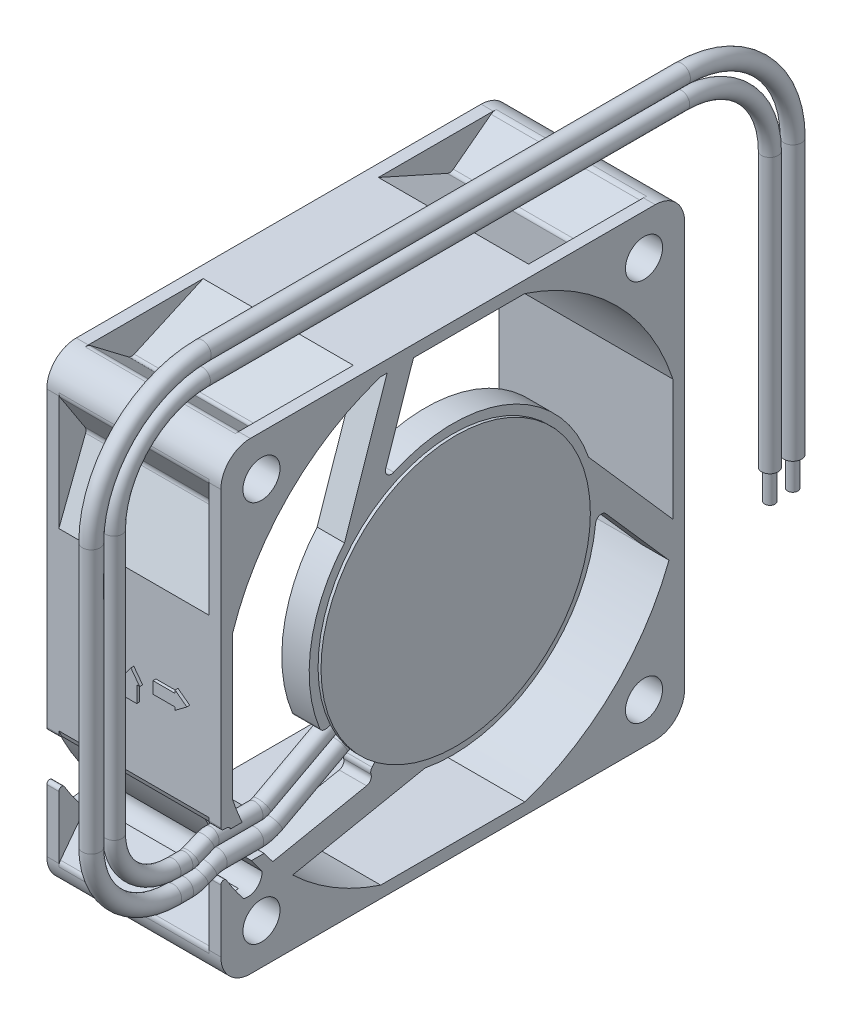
SolidWorks part; units mm, degrees
ref_plane "Front Plane" through (0, 0, 0) normal (0, 0, 1) x (1, 0, 0)
ref_plane "Top Plane" through (0, 0, 0) normal (0, 1, 0) x (1, 0, 0)
ref_plane "Right Plane" through (0, 0, 0) normal (1, 0, 0) x (0, 0, -1)
sketch "Sketch1" plane through (0, 0, 0) normal (1, 0, 0) x (0, 0, -1)
  line L0 (0, 0) -> (0, 40.005) construction
  line L1 (-20.0025, 2.54) -> (-20.0025, 37.465)
  line L2 (20.0025, 2.54) -> (20.0025, 37.465)
  line L3 (-17.4625, 40.005) -> (17.4625, 40.005)
  line L4 (17.4625, 0) -> (-17.4625, 0)
  line L5 (-20.0025, 0) -> (-20.0025, 40.005) construction
  line L6 (20.0025, 0) -> (20.0025, 40.005) construction
  line L7 (-20.0025, 20.0025) -> (20.0025, 20.0025) construction
  arc A0 (-20.0025, 37.465) -> (-17.4625, 40.005) centre (-17.4625, 37.465) cw
  arc A1 (-20.0025, 2.54) -> (-17.4625, 0) centre (-17.4625, 2.54) ccw
  arc A2 (17.4625, 0) -> (20.0025, 2.54) centre (17.4625, 2.54) ccw
  arc A3 (17.4625, 40.005) -> (20.0025, 37.465) centre (17.4625, 37.465) cw
  dimension "D4" = 2.54
  dimension "D1" = 40.005
  dimension "D5" = 20.0025
  dimension "D6" = 17.4625
  dimension "D2" = 20.0025
  dimension "D3" = 20.0025
extrude "Extrude1" add sketch "Sketch1" against normal blind 15.0114
sketch "Sketch2" plane through (0, 0, 0) normal (1, 0, 0) x (0, 0, -1)
  line L0 (0, 40.005) -> (0, 0) construction
  line L1 (17.4625, 40.005) -> (-17.4625, 40.005) construction
  line L2 (-20.0025, 20.0025) -> (20.0025, 20.0025) construction
  line L3 (-20.0025, 37.465) -> (-20.0025, 2.54) construction
  line L4 (20.0025, 2.54) -> (20.0025, 37.465) construction
  line L7 (-17.4625, 0) -> (17.4625, 0) construction
  circle A1 centre (-16.4973, 36.4998) radius 1.6002
  circle A2 centre (16.4973, 36.4998) radius 1.6002
  circle A3 centre (16.4973, 3.5052) radius 1.6002
  circle A4 centre (-16.4973, 3.5052) radius 1.6002
  dimension "D5" = 3.2004
  dimension "D6" = 3.2004
  dimension "D7" = 3.2004
  dimension "D8" = 3.2004
  dimension "D1" = 3.5052
  dimension "D2" = 3.5052
  dimension "D3" = 3.5052
  dimension "D4" = 3.5052
  dimension "D9" = 3.5052
  dimension "D10" = 3.5052
  dimension "D11" = 3.5052
  dimension "D12" = 3.5052
extrude "Extrude2" cut sketch "Sketch2" against normal mid plane 48.0314
sketch "Sketch3" plane through (0, 0, 0) normal (1, 0, 0) x (0, 0, -1)
  line L0 (0, 40.005) -> (0, 0) construction
  line L1 (17.4625, 40.005) -> (-17.4625, 40.005) construction
  line L2 (-20.0025, 20.0025) -> (20.0025, 20.0025) construction
  line L3 (-20.0025, 37.465) -> (-20.0025, 2.54) construction
  line L4 (20.0025, 2.54) -> (20.0025, 37.465) construction
  line L5 (11.7132, 24.0184) -> (18.9865, 15.7426)
  line L6 (13.2074, 19.0478) -> (18.6535, 12.8511)
  line L7 (-17.4625, 0) -> (17.4625, 0) construction
  line L8 (-5.7769, 31.9178) -> (-3.3849, 38.989)
  line L9 (-9.3345, 28.1384) -> (-5.6641, 38.989)
  line L10 (-2.3787, 7.8506) -> (-13.8074, 5.5647)
  line L11 (-3.3849, 38.989) -> (6.2135, 38.989)
  line L12 (-7.4305, 9.0419) -> (-15.52, 7.4238)
  line L17 (-6.2135, 38.989) -> (-5.6641, 38.989)
  line L19 (6.2135, 1.016) -> (-6.2135, 1.016)
  line L20 (18.9865, 26.216) -> (18.9865, 15.7426)
  line L25 (-18.9865, 13.789) -> (-18.9865, 26.216)
  arc A0 (-9.3345, 28.1384) -> (-7.2333, 9.9524) centre (0, 20.0025) ccw
  arc A1 (-18.9865, 13.789) -> (-15.52, 7.4238) centre (0, 20.0025) ccw
  arc A2 (-6.2135, 38.989) -> (-18.9865, 26.216) centre (0, 20.0025) ccw
  arc A3 (18.9865, 26.216) -> (6.2135, 38.989) centre (0, 20.0025) ccw
  arc A4 (6.2135, 1.016) -> (18.6535, 12.8511) centre (0, 20.0025) ccw
  arc A5 (11.7132, 24.0184) -> (-5.087, 31.2918) centre (0, 20.0025) ccw
  arc A6 (-13.8074, 5.5647) -> (-6.2135, 1.016) centre (0, 20.0025) ccw
  arc A7 (-2.3787, 7.8506) -> (12.3203, 18.7633) centre (0, 20.0025) ccw
  arc A8 (-5.7769, 31.9178) -> (-5.087, 31.2918) centre (-5.2957, 31.755) ccw
  arc A9 (12.3203, 18.7633) -> (13.2074, 19.0478) centre (12.8258, 18.7125) cw
  arc A10 (-7.4305, 9.0419) -> (-7.2333, 9.9524) centre (-7.5301, 9.5401) ccw
  dimension "D1" = 0.508
  dimension "D5" = 1.016
  dimension "D9" = 12.3825
  dimension "D10" = 19.9773
  dimension "D3" = 1.016
  dimension "D4" = 1.016
  dimension "D8" = 2.159
  dimension "D6" = 3.3849
  dimension "D7" = 18.689
  dimension "D2" = 1.016
  dimension "D11" = 8.2498
  dimension "D12" = 11.7132
  dimension "D13" = 4.2599
  dimension "D14" = 2.159
  dimension "D15" = 78.689
  dimension "D16" = 1.8592
  dimension "D17" = 2.8915
extrude "Extrude3" cut sketch "Sketch3" against normal mid plane 48.0314
sketch "Sketch4" plane through (-15.0114, 0, 0) normal (-1, 0, 0) x (0, 0, 1)
  line L0 (-20.0025, 2.54) -> (-20.0025, 37.465) construction
  line L1 (3.3849, 38.989) -> (5.7769, 31.9178)
  line L2 (20.0025, 37.465) -> (20.0025, 2.54) construction
  line L3 (5.6641, 38.989) -> (9.3345, 28.1384)
  line L6 (15.52, 7.4238) -> (7.4305, 9.0419)
  line L7 (13.8074, 5.5647) -> (2.3787, 7.8506)
  line L8 (-18.6535, 12.8511) -> (-13.2074, 19.0478)
  line L9 (-18.9865, 15.7426) -> (-11.7132, 24.0184)
  line L12 (5.6641, 38.989) -> (3.3849, 38.989)
  arc A5 (13.8074, 5.5647) -> (15.52, 7.4238) centre (-17.3441, 35.98) ccw
  arc A6 (-18.6535, 12.8511) -> (-18.9865, 15.7426) centre (-6.2674, 15.7426) cw
  arc A7 (-13.2074, 19.0478) -> (-12.3203, 18.7633) centre (-12.8258, 18.7125) cw
  arc A8 (7.4305, 9.0419) -> (7.2333, 9.9524) centre (7.5301, 9.5401) cw
  arc A9 (5.7769, 31.9178) -> (5.087, 31.2918) centre (5.2957, 31.755) cw
  arc A10 (5.087, 31.2918) -> (-11.7132, 24.0184) centre (0, 20.0025) ccw
  arc A11 (-12.3203, 18.7633) -> (2.3787, 7.8506) centre (0, 20.0025) ccw
  arc A12 (7.2333, 9.9524) -> (9.3345, 28.1384) centre (0, 20.0025) ccw
  dimension "D1" = 13.7351
  dimension "D2" = 37.3466
extrude "Extrude4" cut sketch "Sketch4" against normal blind 12.6492
sketch "Sketch5" plane through (-2.3622, 0, 0) normal (-1, 0, 0) x (0, 0, 1)
  line L0 (19.58, 11.938) -> (20.0025, 11.938)
  line L1 (20.0025, 37.465) -> (20.0025, 2.54) construction
  line L2 (20.0025, 11.938) -> (20.0025, 8.8565)
  line L3 (17.4625, 0) -> (-17.4625, 0) construction
  arc A0 (15.7053, 6.264) -> (19.8314, 13.5125) centre (0, 20.0025) ccw construction
  arc A1 (16.4515, 7.1668) -> (18.0535, 5.9169) centre (17.6885, 7.1006) ccw
  arc A2 (16.2107, 6.8641) -> (19.8314, 13.5125) centre (0, 20.0025) ccw
  arc A3 (16.4515, 7.1668) -> (19.1146, 11.6337) centre (0, 20.0025) ccw
  arc A4 (18.0535, 5.9169) -> (20.0025, 8.8565) centre (0, 20.0025) ccw
  arc A5 (19.1146, 11.6337) -> (19.58, 11.938) centre (19.58, 11.43) cw
  arc A7 (17.2347, 4.9261) -> (21.7626, 12.8805) centre (0, 20.0025) ccw construction
  dimension "D1" = 0.508
  dimension "D4" = 1.2388
  dimension "D2" = 5.9169
  dimension "D6" = 0.4225
  dimension "D7" = 7.1668
  dimension "D3" = 0.889
  dimension "D5" = 2.032
extrude "Extrude5" cut sketch "Sketch5" against normal mid plane 35.5092
fillet "Fillet4" radius 0.254 2 edges at (-7.5057, 8.8565, 20.0025) (-7.5057, 11.938, 20.0025)
sketch "Sketch6" plane through (0, 0, 0) normal (1, 0, 0) x (0, 0, -1)
  line L0 (0, 40.005) -> (0, 0) construction
  line L1 (17.4625, 40.005) -> (-17.4625, 40.005) construction
  line L2 (20.0025, 20.0025) -> (-20.0025, 20.0025) construction
  line L3 (20.0025, 2.54) -> (20.0025, 37.465) construction
  line L4 (-20.0025, 37.465) -> (-20.0025, 12.192) construction
  line L5 (-18.823, 6.9629) -> (0, 20.0025) construction
  line L6 (-6.0353, 11.283) -> (-7.2141, 9.8874)
  line L7 (-9.6023, 15.5025) -> (-11.2838, 14.9033)
  arc A0 (-19.5318, 8.0509) -> (-18.0535, 5.9169) centre (0, 20.0025) ccw construction
  arc A1 (-7.1872, 9.9193) -> (-11.2838, 14.9033) centre (0, 20.0025) cw
  arc A3 (-6.0353, 11.283) -> (-9.6023, 15.5025) centre (0, 20.0025) cw
  arc A4 (-6.843, 11.9013) -> (-9.9893, 16.4432) centre (0, 20.0025) cw construction
  arc A5 (-7.9903, 10.543) -> (-11.6642, 15.8464) centre (0, 20.0025) cw construction
  dimension "D1" = 12.3825
  dimension "D5" = 10.6045
  dimension "D2" = 15.1
  dimension "D4" = 15.1
  dimension "D6" = 1.8268
  dimension "D7" = 8.6636
  dimension "D8" = 7.7829
  dimension "D9" = 5.0992
  dimension "D3" = 1.778
extrude "Extrude6" cut sketch "Sketch6" against normal blind 35.5092 contours L6 A3 L7 A1 M23
fillet "Fillet5" radius 0.508 1 edges at (-1.1811, 9.9524, 7.2333)
fillet "Fillet6" radius 0.508 1 edges at (-1.1811, 9.9193, 7.1872)
fillet "Fillet7" radius 0.508 1 edges at (-1.1811, 14.9033, 11.2838)
ref_plane "Plane2" through (-1.016, 0, 0) normal (1, 0, 0) x (0, 0, -1)
sketch "Sketch14" plane through (-1.016, 0, 0) normal (1, 0, 0) x (0, 0, -1)
  line L0 (20.0025, 2.54) -> (20.0025, 12.446)
  line L1 (-17.4625, 40.005) -> (-7.5565, 40.005)
  line L2 (20.0025, 37.465) -> (17.2085, 33.782)
  line L3 (-20.0025, 2.54) -> (-20.0025, 12.446)
  line L4 (-17.6016, 33.782) -> (-20.0025, 27.559)
  line L5 (-17.4625, 0) -> (-7.5565, 0)
  line L7 (17.2085, 33.782) -> (20.0025, 27.559)
  line L8 (-17.4625, 40.005) -> (-13.7795, 37.211)
  line L9 (17.4625, 40.005) -> (13.7795, 37.211)
  line L10 (13.7795, 37.211) -> (7.5565, 40.005)
  line L12 (-7.5565, 40.005) -> (-13.7795, 37.211)
  line L15 (20.0025, 37.465) -> (20.0025, 27.559)
  line L16 (17.4625, 0) -> (7.5565, 0)
  line L17 (-20.0025, 20.0025) -> (20.0025, 20.0025) construction
  line L18 (0, 0) -> (0, 40.005) construction
  line L24 (7.5565, 40.005) -> (17.4625, 40.005)
  line L25 (-17.6016, 33.782) -> (-20.0025, 37.465)
  line L29 (20.0025, 2.54) -> (17.2085, 6.223)
  line L32 (17.2085, 6.223) -> (20.0025, 12.446)
  line L34 (-20.0025, 2.54) -> (-17.2085, 6.223)
  line L35 (17.4625, 0) -> (13.7795, 2.794)
  line L36 (13.7795, 2.794) -> (7.5565, 0)
  line L37 (-17.4625, 0) -> (-13.7795, 2.794)
  line L38 (-13.7795, 2.794) -> (-7.5565, 0)
  line L46 (-17.2085, 6.223) -> (-20.0025, 12.446)
  line L49 (-20.0025, 27.559) -> (-20.0025, 37.465)
  arc A0 (-17.4625, 40.005) -> (-20.0025, 37.465) centre (-17.4625, 37.465) ccw construction
  dimension "D14" = 7.5565
  dimension "D5" = 6.223
  dimension "D6" = 4.6229
  dimension "D7" = 4.6229
  dimension "D8" = 6.8214
  dimension "D9" = 7.5565
  dimension "D10" = 7.5565
  dimension "D11" = 6.223
  dimension "D12" = 4.6229
  dimension "D13" = 4.6229
  dimension "D15" = 15.113
  dimension "D16" = 6.223
  dimension "D17" = 6.223
  dimension "D18" = 6.223
  dimension "D19" = 15.113
  dimension "D20" = 7.5565
  dimension "D21" = 6.223
  dimension "D22" = 4.3965
  dimension "D23" = 9.906
  dimension "D24" = 6.223
  dimension "D25" = 4.6229
  dimension "D26" = 4.6229
  dimension "D27" = 15.113
  dimension "D28" = 17.6016
  dimension "D29" = 20.0025
  dimension "D30" = 20.0025
  dimension "D31" = 20.0025
  dimension "D32" = 17.2085
  dimension "D33" = 4.8493
  dimension "D34" = 9.906
  dimension "D35" = 5.1348
  dimension "D4" = 9.906
extrude "Extrude12" cut sketch "Sketch14" against normal blind 12.954
fillet "Fillet8" radius 0.508 7 edges at (-7.493, 33.782, 17.6016) (-7.493, 2.794, 13.7795) (-7.493, 2.794, -13.7795) (-7.493, 6.223, -17.2085) (-7.493, 33.782, -17.2085) (-7.493, 37.211, -13.7795) (-7.493, 37.211, 13.7795)
fillet "Fillet9" radius 0.635 1 edges at (-7.493, 37.465, -20.0025)
fillet "Fillet10" radius 0.635 1 edges at (-7.493, 40.005, -17.4625)
fillet "Fillet11" radius 0.635 6 edges at (-7.493, 40.005, 17.4625) (-7.493, 37.465, 20.0025) (-7.493, 2.54, 20.0025) (-7.493, 0, 17.4625) (-7.493, 0, -17.4625) (-7.493, 2.54, -20.0025)
sketch "Sketch15" plane through (0, 0, 0) normal (1, 0, 0) x (0, 0, -1)
  line L2 (-19.8174, 8.4168) -> (-13.407, 8.4168)
  line L3 (-19.775, 11.6854) -> (-13.9908, 11.6854)
  line L4 (-19.775, 11.6854) -> (-19.8174, 8.4168)
  line L5 (-13.407, 8.4168) -> (-13.9908, 11.6854)
  arc A1 (-19.5318, 8.0509) -> (-20.0025, 7.9183) centre (-19.7485, 7.9183) ccw construction
  dimension "D1" = 0.4985
  dimension "D2" = 0.2526
  dimension "D3" = 3.2686
  dimension "D4" = 5.7842
  dimension "D5" = 6.4104
extrude "Extrude13" cut sketch "Sketch15" against normal blind 2.54
ref_point "Point1"
ref_plane "Plane5" through (0, 0, 7.0636) normal (0, 0, 1) x (1, 0, 0)
sketch "Sketch19" plane through (0, 0, 7.0636) normal (0, 0, 1) x (1, 0, 0)
  line L7 (-1.016, -22.0027) -> (-1.016, 22.0027) construction
  circle A1 centre (-1.016, 14.432) radius 0.635
  dimension "D1" = 1.27
  dimension "D3" = 1.3106
extrude "Extrude14" cut sketch "Sketch19" against normal mid plane 5.334
sketch "Sketch21" plane through (0, 0, 7.0636) normal (0, 0, 1) x (1, 0, 0)
  circle A0 centre (-1.016, 14.432) radius 0.705
sketch "Sketch22" plane through (-1.016, 0, 0) normal (1, 0, 0) x (0, 0, -1)
  line L0 (-7.0636, 14.432) -> (-8.9568, 14.432)
  line L1 (-9.5558, 14.2819) -> (-10.9986, 13.5102)
  line L2 (-10.9986, 13.5102) -> (-15.457, 11.1255)
  line L3 (-16.0559, 10.9754) -> (-19.8386, 10.9754)
  line L4 (-20.3148, 10.8828) -> (-21.6281, 10.3516)
  line L5 (-22.1043, 10.2589) -> (-23.1272, 10.2589)
  line L6 (-7.4305, 9.0419) -> (-15.52, 7.4238) construction
  line L7 (-28.2072, 15.3389) -> (-28.2072, 38.0638)
  line L8 (-20.5872, 45.6838) -> (20.7501, 45.6838)
  line L9 (28.3701, 38.0638) -> (28.3701, 14.432)
  line L10 (17.4625, 40.005) -> (-17.4625, 40.005) construction
  arc A0 (-19.5318, 8.0509) -> (-20.0025, 7.9183) centre (-19.7485, 7.9183) ccw construction
  arc A1 (-18.0535, 5.9169) -> (-16.4515, 7.1668) centre (-17.6885, 7.1006) ccw construction
  arc A2 (-28.2072, 38.0638) -> (-20.5872, 45.6838) centre (-20.5872, 38.0638) cw
  arc A3 (20.7501, 45.6838) -> (28.3701, 38.0638) centre (20.7501, 38.0638) cw
  arc A4 (-28.2072, 15.3389) -> (-23.1272, 10.2589) centre (-23.1272, 15.3389) ccw
  arc A5 (-21.6281, 10.3516) -> (-22.1043, 10.2589) centre (-22.1043, 11.5289) cw
  arc A6 (-20.3148, 10.8828) -> (-19.8386, 10.9754) centre (-19.8386, 9.7054) cw
  arc A7 (-16.0559, 10.9754) -> (-15.457, 11.1255) centre (-16.0559, 12.2454) ccw
  arc A8 (-9.5558, 14.2819) -> (-8.9568, 14.432) centre (-8.9568, 13.162) cw
  point P3 (-19.8174, 8.1628)
  point P26 (-28.2072, 45.6838)
  point P29 (28.3701, 45.6838)
  point P32 (-28.2072, 10.2589)
  point P36 (-21.8572, 10.2589)
  point P41 (-15.7376, 10.9754)
  dimension "D10" = 7.62
  dimension "D11" = 5.08
  dimension "D12" = 1.27
  dimension "D1" = 6.35
  dimension "D2" = 1.8547
  dimension "D3" = 10.2449
  dimension "D4" = 2.7081
  dimension "D5" = 3.5253
  dimension "D6" = 16.83
  dimension "D7" = 3.8748
  dimension "D8" = 56.5774
  dimension "D9" = 5.6788
sketch "Sketch23" plane through (0, 0, 7.0636) normal (0, 0, 1) x (1, 0, 0)
  circle A0 centre (-1.172, 12.5597) radius 0.762
  dimension "D1" = 1.524
ref_plane "Plane6" through (-1.169, 0, 0) normal (1, 0, 0) x (0, 0, -1)
extrude "Extrude17" add sketch "Sketch23" along normal blind 2.5564
ref_plane "Plane8" through (0, 0, 110.5982) normal (0, 0, 1) x (1, 0, 0)
ref_plane "Plane9" through (0, 0, 110.6857) normal (0, 0, 1) x (1, 0, 0)
ref_plane "Plane10" through (0, 0, 110.6887) normal (0, 0, 1) x (1, 0, 0)
sketch "Sketch31" plane through (0, 0, 20.0025) normal (0, 0, 1) x (1, 0, 0)
  line L0 (-7.5057, 25.019) -> (-7.5057, 14.986) construction
  line L1 (-13.9954, 20.0025) -> (-1.016, 20.0025) construction
  line L2 (-15.0114, 37.465) -> (-15.0114, 12.192) construction
  line L3 (-13.97, 12.446) -> (-1.016, 12.446) construction
  line L4 (-8.0137, 18.0975) -> (-6.9977, 18.0975)
  line L7 (-5.6007, 20.5105) -> (-5.6007, 19.4945)
  line L10 (-6.9977, 19.4945) -> (-6.7437, 19.4945)
  line L13 (-8.2677, 19.4945) -> (-8.0137, 19.4945)
  line L14 (-8.0137, 19.4945) -> (-8.0137, 18.0975)
  line L15 (-3.6957, 20.7645) -> (-3.6957, 20.5105)
  line L18 (-6.9977, 19.4945) -> (-6.9977, 18.0975)
  line L19 (-13.9954, 19.4945) -> (-1.016, 19.4945) construction
  line L20 (-13.9954, 18.0975) -> (-1.016, 18.0975) construction
  line L21 (-5.6007, 20.5105) -> (-3.6957, 20.5105)
  line L22 (-5.6007, 19.4945) -> (-3.6957, 19.4945)
  line L23 (-5.6007, 25.019) -> (-5.6007, 14.986) construction
  line L25 (-3.6957, 20.5105) -> (-3.6957, 19.4945) construction
  line L26 (-7.5057, 20.5105) -> (-8.2677, 19.4945)
  line L27 (-7.5057, 20.5105) -> (-6.7437, 19.4945)
  line L28 (-3.6957, 20.7645) -> (-2.6797, 20.0025)
  line L29 (-2.6797, 20.0025) -> (-3.6957, 19.2405)
  line L30 (-3.6957, 19.2405) -> (-3.6957, 19.4945)
  dimension "D11" = 36.87
  dimension "D16" = 53.13
  dimension "D17" = 36.87
  dimension "D2" = 1.6637
  dimension "D3" = 6.7437
  dimension "D4" = 1.143
  dimension "D5" = 1.905
  dimension "D6" = 1.016
  dimension "D7" = 5.6515
  dimension "D8" = 0.254
extrude "Extrude21" add sketch "Sketch31" along normal blind 0.254
ref_plane "Plane11" through (0, 14.42, 0) normal (0, 1, 0) x (-1, 0, 0)
sweep "Sweep1" add profiles "Sketch21" path "Sketch22"
sketch "Sketch39" plane through (-1.016, 0, 0) normal (1, 0, 0) x (0, 0, -1)
  line L2 (-14.5255, 9.384) -> (-8.6243, 12.5404)
  line L3 (-14.5255, 9.384) -> (-8.9049, 12.3903)
  line L5 (-19.8386, 9.0004) -> (-16.0559, 9.0004)
  line L6 (-19.2072, 9.0004) -> (-16.0559, 9.0004)
  line L8 (-20.8876, 8.5207) -> (-19.5742, 9.0519)
  line L9 (-20.8876, 8.5207) -> (-20.1596, 8.8151)
  line L11 (-23.1272, 8.2839) -> (-22.1043, 8.2839)
  line L12 (-23.1272, 8.2839) -> (-22.1043, 8.2839)
  line L14 (-30.1822, 38.0638) -> (-30.1822, 15.3389)
  line L15 (-30.1822, 38.0638) -> (-30.1822, 15.3389)
  line L17 (20.7501, 47.6588) -> (-20.5872, 47.6588)
  line L18 (20.7501, 47.6588) -> (-20.5872, 47.6588)
  line L19 (-8.306, 12.5404) -> (-6.6099, 12.5404)
  line L20 (30.3451, 14.432) -> (30.3451, 38.0638)
  line L21 (30.3451, 14.432) -> (30.3451, 38.0638)
  arc A2 (-16.0559, 9.0004) -> (-14.5255, 9.384) centre (-16.0559, 12.2454) ccw
  arc A3 (-16.0559, 9.0004) -> (-14.5255, 9.384) centre (-16.0559, 12.2454) ccw
  arc A5 (-22.1043, 8.2839) -> (-20.8876, 8.5207) centre (-22.1043, 11.5289) ccw
  arc A6 (-22.1043, 8.2839) -> (-20.8876, 8.5207) centre (-22.1043, 11.5289) ccw
  arc A8 (-30.1822, 15.3389) -> (-23.1272, 8.2839) centre (-23.1272, 15.3389) ccw
  arc A9 (-30.1822, 15.3389) -> (-23.1272, 8.2839) centre (-23.1272, 15.3389) ccw
  arc A11 (-20.5872, 47.6588) -> (-30.1822, 38.0638) centre (-20.5872, 38.0638) ccw
  arc A12 (-20.5872, 47.6588) -> (-30.1822, 38.0638) centre (-20.5872, 38.0638) ccw
  arc A13 (-20.1596, 8.8151) -> (-19.2072, 9.0004) centre (-19.2072, 6.4604) cw
  arc A14 (30.3451, 38.0638) -> (20.7501, 47.6588) centre (20.7501, 38.0638) ccw
  arc A15 (30.3451, 38.0638) -> (20.7501, 47.6588) centre (20.7501, 38.0638) ccw
  arc A16 (-8.9049, 12.3903) -> (-8.306, 12.5404) centre (-8.306, 11.2704) cw
  dimension "D13" = 2.54
  dimension "D14" = 1.27
  dimension "D1" = 1.27
  dimension "D2" = 1.27
  dimension "D3" = 1.27
  dimension "D4" = 1.27
  dimension "D5" = 1.27
  dimension "D6" = 1.27
  dimension "D7" = 1.27
  dimension "D8" = 1.27
  dimension "D9" = 1.27
  dimension "D10" = 1.27
  dimension "D11" = 1.27
  dimension "D12" = 1.27
sketch "Sketch40" plane through (0, 14.432, 0) normal (0, -1, 0) x (1, 0, 0)
  circle A0 centre (-1.0076, -30.3329) radius 0.762
  dimension "D1" = 1.524
sweep "Sweep2" add profiles "Sketch40" path "Sketch39"
sketch "Sketch41" plane through (0, 0, 0) normal (1, 0, 0) x (0, 0, -1)
  line L0 (7.3811, 10.0604) -> (-10.3651, 33.964) construction
  line L1 (-8.005, 13.2353) -> (14.0843, 31.9089) construction
  line L2 (-12.3825, 20.0025) -> (17.662, 20.0025) construction
  line L3 (0, 7.62) -> (0, 32.385) construction
  arc A0 (-2.3787, 7.8506) -> (12.3203, 18.7633) centre (0, 20.0025) ccw construction
  arc A1 (-9.3345, 28.1384) -> (-11.4757, 15.3512) centre (0, 20.0025) ccw construction
  arc A2 (11.7132, 24.0184) -> (-5.087, 31.2918) centre (0, 20.0025) ccw construction
  circle A3 centre (0, 20.0025) radius 11.6171
  dimension "D1" = 23.2342
extrude "Extrude22" add sketch "Sketch41" along normal blind 0.254
sketch "Sketch42" plane through (0, 0, 0) normal (0, -1, 0) x (1, 0, 0)
  line L0 (-15.0114, 0) -> (0, 0) construction
  line L1 (-15.0114, 17.4625) -> (-15.0114, -17.4625) construction
  line L2 (-7.493, 7.5565) -> (-7.493, -7.5565) construction
  line L3 (-13.97, 7.5565) -> (-1.016, 7.5565) construction
  line L4 (-13.97, -7.5565) -> (-1.016, -7.5565) construction
sketch "Sketch43" plane through (0, 14.432, 0) normal (0, -1, 0) x (1, 0, 0)
  circle A0 centre (-1.016, -28.3701) radius 0.4445
  circle A1 centre (-1.0076, -30.3329) radius 0.4445
  dimension "D1" = 0.889
  dimension "D2" = 0.889
extrude "Extrude23" add sketch "Sketch43" along normal blind 2.54
